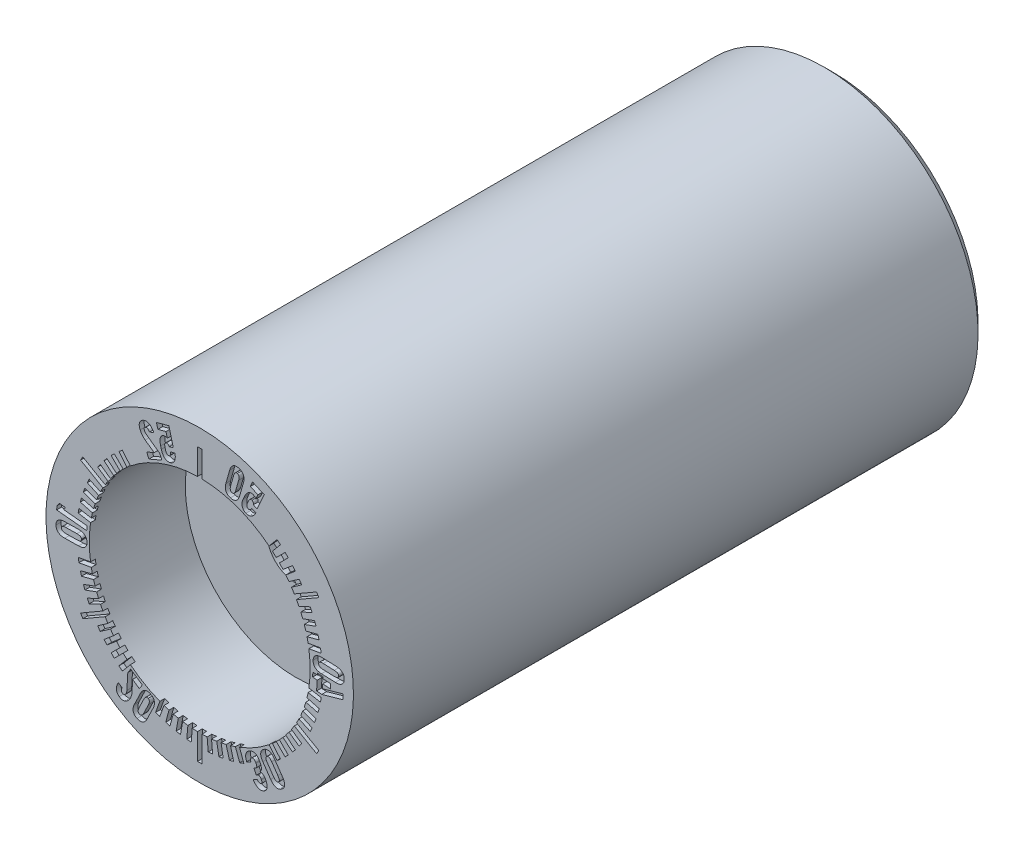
SolidWorks part; units mm, degrees
ref_plane "Front Plane" through (0, 0, 0) normal (0, 0, 1) x (1, 0, 0)
ref_plane "Top Plane" through (0, 0, 0) normal (0, 1, 0) x (1, 0, 0)
ref_plane "Right Plane" through (0, 0, 0) normal (1, 0, 0) x (0, 0, -1)
sketch "Sketch1" plane through (0, 0, 0) normal (1, 0, 0) x (0, 0, -1)
  line L0 (0, 0) -> (-75.4695, 0) construction
  line L2 (33, 4) -> (33, 7.5)
  line L4 (32.5, 8) -> (0, 8)
  line L5 (0, 8) -> (0, 5.75)
  line L7 (0, 5.75) -> (5, 5.75)
  line L8 (5, 5.75) -> (5, 1.5)
  line L9 (5, 1.5) -> (24, 1.5)
  line L10 (33, 4) -> (24, 4)
  line L11 (24, 1.5) -> (24, 4)
  line L12 (33, 7.5) -> (32.5, 8)
  point P6 (33, 8)
  dimension "D1" = 33
  dimension "D2" = 16
  dimension "D3" = 11.5
  dimension "D4" = 5
  dimension "D5" = 3
  dimension "D6" = 8
  dimension "D7" = 9
revolve "Revolve1" add sketch "Sketch1" angle 360 about L0
sketch "Sketch2" plane through (0, 0, 0) normal (0, 0, 1) x (1, 0, 0)
  line L0 (0, 0) -> (0, 9.1999) construction
  line L1 (0, 0) -> (0, -9.4359) construction
  line L2 (-0.614, -5.6982) -> (-0.3848, -5.7182)
  line L3 (-0.115, 7.09) -> (0.115, 7.09)
  line L4 (-0.115, 7.09) -> (-0.115, 5.73)
  line L5 (-0.115, 5.73) -> (0.115, 5.73)
  line L6 (0.115, 7.09) -> (0.115, 5.73)
  line L7 (6.0826, 3.6446) -> (6.1976, 3.4454)
  line L8 (6.1976, 3.4454) -> (5.0198, 2.7654)
  line L9 (6.0826, 3.6446) -> (4.9048, 2.9646)
  line L10 (4.9048, 2.9646) -> (5.0198, 2.7654)
  line L11 (-0.3848, -5.7182) -> (-0.4432, -6.3857)
  line L12 (-0.614, -5.6982) -> (-0.6724, -6.3656)
  line L13 (-0.6724, -6.3656) -> (-0.4432, -6.3857)
  line L14 (-1.1083, -5.623) -> (-0.8818, -5.6629)
  line L15 (-0.8818, -5.6629) -> (-0.9981, -6.3227)
  line L16 (-1.1083, -5.623) -> (-1.2246, -6.2828)
  line L17 (-1.2246, -6.2828) -> (-0.9981, -6.3227)
  line L18 (-1.5941, -5.505) -> (-1.372, -5.5645)
  line L19 (-1.372, -5.5645) -> (-1.5454, -6.2117)
  line L20 (-1.5941, -5.505) -> (-1.7675, -6.1522)
  line L21 (-1.7675, -6.1522) -> (-1.5454, -6.2117)
  line L22 (-2.0678, -5.3451) -> (-1.8517, -5.4238)
  line L23 (-1.8517, -5.4238) -> (-2.0809, -6.0534)
  line L24 (-2.0678, -5.3451) -> (-2.297, -5.9747)
  line L25 (-2.297, -5.9747) -> (-2.0809, -6.0534)
  line L26 (2.4456, -5.8294) -> (2.662, -5.7219)
  line L27 (2.916, -5.6259) -> (2.9326, -5.659)
  line L28 (2.9148, -5.8787) -> (2.8208, -5.9254)
  line L29 (2.8208, -5.9254) -> (2.949, -6.1828)
  line L30 (2.949, -6.1828) -> (3.043, -6.1361)
  line L31 (3.1992, -6.2407) -> (3.2113, -6.2652)
  line L32 (2.9953, -6.3472) -> (2.7799, -6.4546)
  line L33 (3.4495, -6.1807) -> (3.4282, -6.1379)
  line L34 (3.1469, -5.5269) -> (3.1256, -5.4841)
  line L35 (3.2837, -5.4055) -> (3.6928, -5.9979)
  line L36 (4.3062, -5.5741) -> (3.8972, -4.9817)
  line L37 (3.747, -5.178) -> (4.0695, -5.6451)
  line L38 (-3.7713, -4.3155) -> (-3.5951, -4.4634)
  line L39 (-3.5951, -4.4634) -> (-4.0257, -4.9766)
  line L40 (-3.7713, -4.3155) -> (-4.2019, -4.8288)
  line L41 (-4.2019, -4.8288) -> (-4.0257, -4.9766)
  line L42 (-4.133, -3.9704) -> (-3.9704, -4.133)
  line L43 (-3.9704, -4.133) -> (-4.4442, -4.6068)
  line L44 (-4.133, -3.9704) -> (-4.6068, -4.4442)
  line L45 (-4.6068, -4.4442) -> (-4.4442, -4.6068)
  line L46 (-4.4634, -3.5951) -> (-4.3155, -3.7713)
  line L47 (-4.3155, -3.7713) -> (-4.8288, -4.2019)
  line L48 (-4.4634, -3.5951) -> (-4.9766, -4.0257)
  line L49 (-4.9766, -4.0257) -> (-4.8288, -4.2019)
  line L50 (-4.7597, -3.1924) -> (-4.6278, -3.3808)
  line L51 (-4.6278, -3.3808) -> (-5.1766, -3.7651)
  line L52 (-4.7597, -3.1924) -> (-5.3085, -3.5767)
  line L53 (-5.3085, -3.5767) -> (-5.1766, -3.7651)
  line L54 (6.1976, -3.4454) -> (6.0826, -3.6446)
  line L55 (6.0826, -3.6446) -> (4.9048, -2.9646)
  line L56 (6.1976, -3.4454) -> (5.0198, -2.7654)
  line L57 (5.0198, -2.7654) -> (4.9048, -2.9646)
  line L58 (-5.2417, -2.3174) -> (-5.1445, -2.5258)
  line L59 (-5.1445, -2.5258) -> (-5.7518, -2.809)
  line L60 (-5.2417, -2.3174) -> (-5.849, -2.6005)
  line L61 (-5.849, -2.6005) -> (-5.7518, -2.809)
  line L62 (-5.4238, -1.8517) -> (-5.3451, -2.0678)
  line L63 (-5.3451, -2.0678) -> (-5.9747, -2.297)
  line L64 (-5.4238, -1.8517) -> (-6.0534, -2.0809)
  line L65 (-6.0534, -2.0809) -> (-5.9747, -2.297)
  line L66 (-5.5645, -1.372) -> (-5.505, -1.5941)
  line L67 (-5.505, -1.5941) -> (-6.1522, -1.7675)
  line L68 (-5.5645, -1.372) -> (-6.2117, -1.5454)
  line L69 (-6.2117, -1.5454) -> (-6.1522, -1.7675)
  line L70 (-5.6629, -0.8818) -> (-5.623, -1.1083)
  line L71 (-5.623, -1.1083) -> (-6.2828, -1.2246)
  line L72 (-5.6629, -0.8818) -> (-6.3227, -0.9981)
  line L73 (-6.3227, -0.9981) -> (-6.2828, -1.2246)
  line L74 (3.8428, -5.8019) -> (3.5203, -5.3347)
  line L75 (6.3541, -0.8382) -> (7.4436, -0.5291)
  line L76 (7.4436, -0.5291) -> (7.4622, -0.2638)
  line L77 (7.4622, -0.2638) -> (6.3867, -0.5635)
  line L78 (6.3867, -0.5635) -> (6.4023, -0.337)
  line L79 (6.4253, -0.0051) -> (6.1384, 0.0147)
  line L80 (6.1384, 0.0147) -> (6.1316, -0.0826)
  line L81 (6.0805, -0.8191) -> (6.3541, -0.8382)
  line L82 (6.8023, -0.3649) -> (6.8185, -0.1305)
  line L83 (6.8185, -0.1305) -> (6.4185, -0.1026)
  line L84 (5.8883, -0.0657) -> (5.8721, -0.3001)
  line L85 (5.8721, -0.3001) -> (6.1154, -0.317)
  line L86 (-5.623, 1.1083) -> (-5.6629, 0.8818)
  line L87 (-5.6629, 0.8818) -> (-6.3227, 0.9981)
  line L88 (-5.623, 1.1083) -> (-6.2828, 1.2246)
  line L89 (-6.2828, 1.2246) -> (-6.3227, 0.9981)
  line L90 (-5.505, 1.5941) -> (-5.5645, 1.372)
  line L91 (-5.5645, 1.372) -> (-6.2117, 1.5454)
  line L92 (-5.505, 1.5941) -> (-6.1522, 1.7675)
  line L93 (-6.1522, 1.7675) -> (-6.2117, 1.5454)
  line L94 (-5.3451, 2.0678) -> (-5.4238, 1.8517)
  line L95 (-5.4238, 1.8517) -> (-6.0534, 2.0809)
  line L96 (-5.3451, 2.0678) -> (-5.9747, 2.297)
  line L97 (-5.9747, 2.297) -> (-6.0534, 2.0809)
  line L98 (-5.1445, 2.5258) -> (-5.2417, 2.3174)
  line L99 (-5.2417, 2.3174) -> (-5.849, 2.6005)
  line L100 (-5.1445, 2.5258) -> (-5.7518, 2.809)
  line L101 (-5.7518, 2.809) -> (-5.849, 2.6005)
  line L102 (0.115, -7.09) -> (-0.115, -7.09)
  line L103 (-0.115, -7.09) -> (-0.115, -5.73)
  line L104 (0.115, -7.09) -> (0.115, -5.73)
  line L105 (0.115, -5.73) -> (-0.115, -5.73)
  line L106 (-4.6278, 3.3808) -> (-4.7597, 3.1924)
  line L107 (-4.7597, 3.1924) -> (-5.3085, 3.5767)
  line L108 (-4.6278, 3.3808) -> (-5.1766, 3.7651)
  line L109 (-5.1766, 3.7651) -> (-5.3085, 3.5767)
  line L110 (-4.3155, 3.7713) -> (-4.4634, 3.5951)
  line L111 (-4.4634, 3.5951) -> (-4.9766, 4.0257)
  line L112 (-4.3155, 3.7713) -> (-4.8288, 4.2019)
  line L113 (-4.8288, 4.2019) -> (-4.9766, 4.0257)
  line L114 (-3.9704, 4.133) -> (-4.133, 3.9704)
  line L115 (-4.133, 3.9704) -> (-4.6068, 4.4442)
  line L116 (-3.9704, 4.133) -> (-4.4442, 4.6068)
  line L117 (-4.4442, 4.6068) -> (-4.6068, 4.4442)
  line L118 (-3.5951, 4.4634) -> (-3.7713, 4.3155)
  line L119 (-3.7713, 4.3155) -> (-4.2019, 4.8288)
  line L120 (-3.5951, 4.4634) -> (-4.0257, 4.9766)
  line L121 (-4.0257, 4.9766) -> (-4.2019, 4.8288)
  line L122 (6.3372, 0.0845) -> (7.0567, 0.0572)
  line L123 (7.085, 0.8025) -> (6.3655, 0.8298)
  line L124 (6.4329, 0.5921) -> (6.9999, 0.5707)
  line L125 (6.9897, 0.2949) -> (6.4227, 0.3163)
  line L126 (-6.0826, -3.6446) -> (-6.1976, -3.4454)
  line L127 (-6.1976, -3.4454) -> (-5.0198, -2.7654)
  line L128 (-6.0826, -3.6446) -> (-4.9048, -2.9646)
  line L129 (-4.9048, -2.9646) -> (-5.0198, -2.7654)
  line L130 (-6.1976, 3.4454) -> (-6.0826, 3.6446)
  line L131 (-6.0826, 3.6446) -> (-4.9048, 2.9646)
  line L132 (-6.1976, 3.4454) -> (-5.0198, 2.7654)
  line L133 (-5.0198, 2.7654) -> (-4.9048, 2.9646)
  line L134 (6.1316, -0.0826) -> (5.8883, -0.0657)
  line L135 (6.4185, -0.1026) -> (6.4253, -0.0051)
  line L136 (6.4023, -0.337) -> (6.8023, -0.3649)
  line L137 (6.1154, -0.317) -> (6.0805, -0.8191)
  line L182 (3.7713, 4.3155) -> (3.5951, 4.4634)
  line L183 (3.5951, 4.4634) -> (4.0257, 4.9766)
  line L184 (3.7713, 4.3155) -> (4.2019, 4.8288)
  line L185 (4.2019, 4.8288) -> (4.0257, 4.9766)
  line L186 (4.133, 3.9704) -> (3.9704, 4.133)
  line L187 (3.9704, 4.133) -> (4.4442, 4.6068)
  line L188 (4.133, 3.9704) -> (4.6068, 4.4442)
  line L189 (4.6068, 4.4442) -> (4.4442, 4.6068)
  line L190 (4.4634, 3.5951) -> (4.3155, 3.7713)
  line L191 (4.3155, 3.7713) -> (4.8288, 4.2019)
  line L192 (4.4634, 3.5951) -> (4.9766, 4.0257)
  line L193 (4.9766, 4.0257) -> (4.8288, 4.2019)
  line L194 (4.7597, 3.1924) -> (4.6278, 3.3808)
  line L195 (4.6278, 3.3808) -> (5.1766, 3.7651)
  line L196 (4.7597, 3.1924) -> (5.3085, 3.5767)
  line L197 (5.3085, 3.5767) -> (5.1766, 3.7651)
  line L202 (5.2417, 2.3174) -> (5.1445, 2.5258)
  line L203 (5.1445, 2.5258) -> (5.7518, 2.809)
  line L204 (5.2417, 2.3174) -> (5.849, 2.6005)
  line L205 (5.849, 2.6005) -> (5.7518, 2.809)
  line L206 (5.4238, 1.8517) -> (5.3451, 2.0678)
  line L207 (5.3451, 2.0678) -> (5.9747, 2.297)
  line L208 (5.4238, 1.8517) -> (6.0534, 2.0809)
  line L209 (6.0534, 2.0809) -> (5.9747, 2.297)
  line L210 (5.5645, 1.372) -> (5.505, 1.5941)
  line L211 (5.505, 1.5941) -> (6.1522, 1.7675)
  line L212 (5.5645, 1.372) -> (6.2117, 1.5454)
  line L213 (6.2117, 1.5454) -> (6.1522, 1.7675)
  line L214 (5.6629, 0.8818) -> (5.623, 1.1083)
  line L215 (5.623, 1.1083) -> (6.2828, 1.2246)
  line L216 (5.6629, 0.8818) -> (6.3227, 0.9981)
  line L217 (6.3227, 0.9981) -> (6.2828, 1.2246)
  line L230 (5.623, -1.1083) -> (5.6629, -0.8818)
  line L231 (5.6629, -0.8818) -> (6.3227, -0.9981)
  line L232 (5.623, -1.1083) -> (6.2828, -1.2246)
  line L233 (6.2828, -1.2246) -> (6.3227, -0.9981)
  line L234 (5.505, -1.5941) -> (5.5645, -1.372)
  line L235 (5.5645, -1.372) -> (6.2117, -1.5454)
  line L236 (5.505, -1.5941) -> (6.1522, -1.7675)
  line L237 (6.1522, -1.7675) -> (6.2117, -1.5454)
  line L238 (5.3451, -2.0678) -> (5.4238, -1.8517)
  line L239 (5.4238, -1.8517) -> (6.0534, -2.0809)
  line L240 (5.3451, -2.0678) -> (5.9747, -2.297)
  line L241 (5.9747, -2.297) -> (6.0534, -2.0809)
  line L242 (5.1445, -2.5258) -> (5.2417, -2.3174)
  line L243 (5.2417, -2.3174) -> (5.849, -2.6005)
  line L244 (5.1445, -2.5258) -> (5.7518, -2.809)
  line L245 (5.7518, -2.809) -> (5.849, -2.6005)
  line L250 (4.6278, -3.3808) -> (4.7597, -3.1924)
  line L251 (4.7597, -3.1924) -> (5.3085, -3.5767)
  line L252 (4.6278, -3.3808) -> (5.1766, -3.7651)
  line L253 (5.1766, -3.7651) -> (5.3085, -3.5767)
  line L254 (4.3155, -3.7713) -> (4.4634, -3.5951)
  line L255 (4.4634, -3.5951) -> (4.9766, -4.0257)
  line L256 (4.3155, -3.7713) -> (4.8288, -4.2019)
  line L257 (4.8288, -4.2019) -> (4.9766, -4.0257)
  line L258 (3.9704, -4.133) -> (4.133, -3.9704)
  line L259 (4.133, -3.9704) -> (4.6068, -4.4442)
  line L260 (3.9704, -4.133) -> (4.4442, -4.6068)
  line L261 (4.4442, -4.6068) -> (4.6068, -4.4442)
  line L262 (3.5951, -4.4634) -> (3.7713, -4.3155)
  line L263 (3.7713, -4.3155) -> (4.2019, -4.8288)
  line L264 (3.5951, -4.4634) -> (4.0257, -4.9766)
  line L265 (4.0257, -4.9766) -> (4.2019, -4.8288)
  line L278 (1.8517, -5.4238) -> (2.0678, -5.3451)
  line L279 (2.0678, -5.3451) -> (2.297, -5.9747)
  line L280 (1.8517, -5.4238) -> (2.0809, -6.0534)
  line L281 (2.0809, -6.0534) -> (2.297, -5.9747)
  line L282 (1.372, -5.5645) -> (1.5941, -5.505)
  line L283 (1.5941, -5.505) -> (1.7675, -6.1522)
  line L284 (1.372, -5.5645) -> (1.5454, -6.2117)
  line L285 (1.5454, -6.2117) -> (1.7675, -6.1522)
  line L286 (0.8818, -5.6629) -> (1.1083, -5.623)
  line L287 (1.1083, -5.623) -> (1.2246, -6.2828)
  line L288 (0.8818, -5.6629) -> (0.9981, -6.3227)
  line L289 (0.9981, -6.3227) -> (1.2246, -6.2828)
  line L290 (0.3848, -5.7182) -> (0.614, -5.6982)
  line L291 (0.614, -5.6982) -> (0.6724, -6.3656)
  line L292 (0.3848, -5.7182) -> (0.4432, -6.3857)
  line L293 (0.4432, -6.3857) -> (0.6724, -6.3656)
  circle A0 centre (0, 0) radius 5.9 construction
  spline S0 degree 3 poles (2.6045, -5.2554) (2.5726, -5.2714) (2.5278, -5.3006) (2.478, -5.3499) (2.4475, -5.391) (2.4228, -5.4358) (2.4047, -5.4843) (2.3939, -5.5362) (2.3896, -5.5911) (2.3923, -5.6486) (2.4062, -5.73) (2.4281, -5.7898) (2.4456, -5.8294) knots 0 0 0 0 0.161106 0.238201 0.314561 0.390768 0.46798 0.54646 0.629043 0.715177 0.804753 1 1 1 1
  spline S1 degree 3 poles (2.662, -5.7219) (2.6518, -5.6949) (2.6429, -5.6541) (2.6481, -5.6018) (2.6651, -5.5591) (2.6908, -5.5356) (2.7108, -5.5262) knots 0 0 0 0 0.389245 0.552171 0.702169 1 1 1 1
  spline S2 degree 3 poles (2.7108, -5.5262) (2.7289, -5.5177) (2.758, -5.5079) (2.7975, -5.5121) (2.8252, -5.522) (2.8512, -5.5388) (2.8853, -5.5713) (2.9042, -5.6033) (2.916, -5.6259) knots 0 0 0 0 0.234386 0.344211 0.455537 0.57454 0.701359 1 1 1 1
  spline S3 degree 3 poles (2.9326, -5.659) (2.9441, -5.6831) (2.9598, -5.7184) (2.9683, -5.7659) (2.9696, -5.7963) (2.9646, -5.8234) (2.9502, -5.8548) (2.9297, -5.8713) (2.9148, -5.8787) knots 0 0 0 0 0.327056 0.463872 0.585664 0.694908 0.796361 1 1 1 1
  spline S4 degree 3 poles (3.043, -6.1361) (3.0553, -6.1297) (3.0766, -6.1256) (3.1046, -6.1324) (3.125, -6.1439) (3.1451, -6.1605) (3.1719, -6.1921) (3.1892, -6.22) (3.1992, -6.2407) knots 0 0 0 0 0.198238 0.297496 0.408103 0.531348 0.669627 1 1 1 1
  spline S5 degree 3 poles (3.2113, -6.2652) (3.2207, -6.2847) (3.233, -6.3136) (3.2389, -6.3525) (3.2385, -6.3778) (3.2332, -6.4005) (3.2188, -6.4268) (3.2011, -6.4413) (3.1875, -6.4476) knots 0 0 0 0 0.315551 0.448835 0.569436 0.679684 0.783667 1 1 1 1
  spline S6 degree 3 poles (3.1875, -6.4476) (3.1783, -6.4523) (3.1632, -6.4564) (3.1423, -6.4573) (3.1263, -6.4546) (3.1098, -6.45) (3.0933, -6.4425) (3.0766, -6.4327) (3.06, -6.4204) (3.0432, -6.4057) (3.0208, -6.3817) (3.0054, -6.3615) (2.9953, -6.3472) knots 0 0 0 0 0.131372 0.19643 0.264883 0.336662 0.41385 0.494997 0.582418 0.676905 0.777945 1 1 1 1
  spline S7 degree 3 poles (2.7799, -6.4546) (2.8029, -6.4938) (2.841, -6.5485) (2.8993, -6.6123) (2.9445, -6.6513) (2.991, -6.6835) (3.0385, -6.7088) (3.0869, -6.7264) (3.1357, -6.7367) (3.1844, -6.7395) (3.2489, -6.7334) (3.2954, -6.7178) (3.3244, -6.7031) knots 0 0 0 0 0.205722 0.300436 0.390488 0.475582 0.555837 0.633119 0.707862 0.781016 0.852868 1 1 1 1
  spline S8 degree 3 poles (3.3244, -6.7031) (3.3475, -6.6913) (3.3804, -6.6717) (3.4189, -6.6401) (3.4435, -6.6148) (3.4642, -6.5873) (3.4817, -6.558) (3.4951, -6.5265) (3.5053, -6.4934) (3.5118, -6.4587) (3.5141, -6.4226) (3.5129, -6.3852) (3.5076, -6.3465) (3.4989, -6.3066) (3.4815, -6.2502) (3.4633, -6.2085) (3.4495, -6.1807) knots 0 0 0 0 0.127639 0.187303 0.244723 0.300676 0.356461 0.411896 0.468674 0.52651 0.585218 0.646388 0.710215 0.776858 0.84718 1 1 1 1
  spline S9 degree 3 poles (3.4282, -6.1379) (3.4128, -6.107) (3.3861, -6.0636) (3.3411, -6.0149) (3.305, -5.9851) (3.2663, -5.9611) (3.2115, -5.9389) (3.1679, -5.9312) (3.1386, -5.9314) knots 0 0 0 0 0.276132 0.404288 0.528875 0.649662 0.766898 1 1 1 1
  spline S10 degree 3 poles (3.1386, -5.9314) (3.161, -5.911) (3.1878, -5.8723) (3.2061, -5.8119) (3.211, -5.7612) (3.2076, -5.7066) (3.1907, -5.6262) (3.1671, -5.5665) (3.1469, -5.5269) knots 0 0 0 0 0.208986 0.317147 0.433273 0.559006 0.69352 1 1 1 1
  spline S11 degree 3 poles (3.1256, -5.4841) (3.107, -5.4453) (3.0742, -5.392) (3.0235, -5.3291) (2.9834, -5.2912) (2.9417, -5.2598) (2.8974, -5.2367) (2.8517, -5.2199) (2.804, -5.2119) (2.755, -5.211) (2.6865, -5.2206) (2.6368, -5.2397) (2.6045, -5.2554) knots 0 0 0 0 0.199663 0.289879 0.374673 0.454952 0.531757 0.606027 0.680061 0.755356 0.832919 1 1 1 1
  spline S12 degree 3 poles (3.3346, -4.8235) (3.3108, -4.8396) (3.2781, -4.8664) (3.2412, -4.9071) (3.2189, -4.9387) (3.2009, -4.9716) (3.1871, -5.0061) (3.1781, -5.0422) (3.1733, -5.0796) (3.1727, -5.1182) (3.1762, -5.1574) (3.1842, -5.1973) (3.1957, -5.238) (3.2117, -5.2791) (3.2391, -5.3364) (3.2648, -5.378) (3.2837, -5.4055) knots 0 0 0 0 0.129871 0.190225 0.247875 0.304196 0.359503 0.415159 0.471987 0.529676 0.588904 0.649887 0.713335 0.779641 0.84894 1 1 1 1
  spline S13 degree 3 poles (3.6928, -5.9979) (3.7118, -6.0256) (3.742, -6.0646) (3.7861, -6.1108) (3.8192, -6.1403) (3.8532, -6.1655) (3.8877, -6.1871) (3.9234, -6.2039) (3.9594, -6.217) (3.9961, -6.2257) (4.033, -6.2295) (4.0699, -6.2289) (4.107, -6.2238) (4.1443, -6.2139) (4.1952, -6.1937) (4.2315, -6.1724) (4.2552, -6.1564) knots 0 0 0 0 0.152206 0.222058 0.288529 0.352082 0.413336 0.472219 0.52994 0.586186 0.641826 0.697123 0.752898 0.810629 0.870722 1 1 1 1
  spline S14 degree 3 poles (4.2552, -6.1564) (4.2786, -6.1398) (4.3118, -6.1136) (4.3485, -6.0728) (4.3708, -6.0413) (4.3891, -6.0086) (4.4032, -5.9743) (4.4125, -5.9384) (4.4175, -5.9011) (4.418, -5.8629) (4.4149, -5.8237) (4.4068, -5.784) (4.3953, -5.7431) (4.3791, -5.7018) (4.3515, -5.6439) (4.3251, -5.602) (4.3062, -5.5741) knots 0 0 0 0 0.129652 0.189922 0.247023 0.303334 0.358575 0.414101 0.470268 0.527877 0.586376 0.647274 0.710633 0.777531 0.847419 1 1 1 1
  spline S15 degree 3 poles (3.8972, -4.9817) (3.8781, -4.9539) (3.8479, -4.915) (3.8037, -4.8686) (3.7706, -4.8393) (3.7366, -4.8139) (3.7022, -4.7924) (3.6665, -4.7756) (3.6305, -4.7626) (3.5939, -4.7539) (3.5569, -4.7499) (3.5198, -4.7511) (3.4826, -4.7558) (3.4455, -4.766) (3.3946, -4.786) (3.3583, -4.8074) (3.3346, -4.8235) knots 0 0 0 0 0.152176 0.222013 0.288924 0.351999 0.413241 0.472112 0.529822 0.586056 0.641685 0.697151 0.753342 0.810667 0.870748 1 1 1 1
  spline S16 degree 3 poles (3.4982, -5.0604) (3.5157, -5.0485) (3.5463, -5.035) (3.5895, -5.0387) (3.6211, -5.0508) (3.6525, -5.0713) (3.6978, -5.1116) (3.7276, -5.15) (3.747, -5.178) knots 0 0 0 0 0.207401 0.307193 0.41336 0.532363 0.669041 1 1 1 1
  spline S17 degree 3 poles (4.0695, -5.6451) (4.089, -5.673) (4.1138, -5.7145) (4.1357, -5.771) (4.1439, -5.8078) (4.1439, -5.8417) (4.1326, -5.8835) (4.1094, -5.9076) (4.0919, -5.9196) knots 0 0 0 0 0.330238 0.465955 0.586664 0.693024 0.79226 1 1 1 1
  spline S18 degree 3 poles (4.0919, -5.9196) (4.0744, -5.9316) (4.0437, -5.9449) (4.0006, -5.9408) (3.969, -5.9288) (3.9375, -5.9083) (3.8922, -5.8679) (3.8622, -5.8298) (3.8428, -5.8019) knots 0 0 0 0 0.208249 0.306744 0.412902 0.532913 0.66958 1 1 1 1
  spline S19 degree 3 poles (3.5203, -5.3347) (3.5011, -5.3066) (3.4755, -5.2653) (3.4539, -5.2085) (3.4461, -5.1717) (3.4459, -5.1379) (3.4579, -5.0964) (3.4806, -5.0723) (3.4982, -5.0604) knots 0 0 0 0 0.331048 0.467565 0.587735 0.694108 0.792236 1 1 1 1
  spline S20 degree 3 poles (5.9016, 0.4743) (5.9007, 0.4456) (5.9018, 0.4031) (5.9132, 0.3493) (5.9247, 0.3125) (5.9403, 0.2782) (5.9597, 0.2464) (5.9832, 0.2175) (6.0104, 0.1913) (6.0408, 0.1676) (6.0746, 0.1473) (6.111, 0.1294) (6.1506, 0.1145) (6.1931, 0.1028) (6.2552, 0.0897) (6.304, 0.0861) (6.3372, 0.0845) knots 0 0 0 0 0.130183 0.190304 0.248065 0.304374 0.360053 0.415608 0.472265 0.530407 0.589415 0.650323 0.713491 0.779906 0.849589 1 1 1 1
  spline S21 degree 3 poles (7.0567, 0.0572) (7.0903, 0.0562) (7.1397, 0.0566) (7.2032, 0.0646) (7.2467, 0.0731) (7.2874, 0.085) (7.3252, 0.1002) (7.3602, 0.1184) (7.3921, 0.1397) (7.4208, 0.164) (7.4462, 0.1911) (7.4675, 0.2213) (7.4859, 0.254) (7.4999, 0.2899) (7.5142, 0.3427) (7.5196, 0.3844) (7.5203, 0.4131) knots 0 0 0 0 0.152073 0.222273 0.288816 0.352284 0.413223 0.472651 0.530126 0.58636 0.642109 0.697247 0.753072 0.810939 0.87087 1 1 1 1
  spline S22 degree 3 poles (7.5203, 0.4131) (7.5217, 0.4418) (7.5194, 0.4839) (7.5097, 0.538) (7.4977, 0.5747) (7.4827, 0.609) (7.4633, 0.6405) (7.4405, 0.6697) (7.4136, 0.6958) (7.3834, 0.7192) (7.3499, 0.7398) (7.3135, 0.7578) (7.2737, 0.7721) (7.2312, 0.7846) (7.1681, 0.7967) (7.1188, 0.801) (7.085, 0.8025) knots 0 0 0 0 0.129601 0.189846 0.247559 0.303577 0.358531 0.414044 0.470273 0.527288 0.586456 0.647314 0.710308 0.777229 0.847291 1 1 1 1
  spline S23 degree 3 poles (6.3655, 0.8298) (6.3319, 0.8308) (6.2826, 0.8302) (6.2191, 0.8226) (6.1756, 0.8133) (6.135, 0.8017) (6.0971, 0.7869) (6.0622, 0.7687) (6.0301, 0.7477) (6.0015, 0.7233) (5.9761, 0.6962) (5.9546, 0.6659) (5.9364, 0.6332) (5.9224, 0.5973) (5.9073, 0.5447) (5.9032, 0.5028) (5.9016, 0.4743) knots 0 0 0 0 0.152128 0.222354 0.288607 0.352548 0.413284 0.472062 0.529932 0.586187 0.641957 0.697116 0.753409 0.810831 0.870865 1 1 1 1
  spline S24 degree 3 poles (6.189, 0.4632) (6.1893, 0.4845) (6.1981, 0.5163) (6.2263, 0.5491) (6.2552, 0.5671) (6.2907, 0.5799) (6.3503, 0.5921) (6.3988, 0.5934) (6.4329, 0.5921) knots 0 0 0 0 0.206874 0.305502 0.412665 0.53262 0.669385 1 1 1 1
  spline S25 degree 3 poles (6.9999, 0.5707) (7.034, 0.5696) (7.0821, 0.5643) (7.1406, 0.5481) (7.1748, 0.5324) (7.202, 0.5122) (7.2281, 0.4777) (7.234, 0.4451) (7.2329, 0.4238) knots 0 0 0 0 0.33143 0.466798 0.586952 0.694421 0.792381 1 1 1 1
  spline S26 degree 3 poles (7.2329, 0.4238) (7.2328, 0.4024) (7.2243, 0.3704) (7.1958, 0.3379) (7.167, 0.3201) (7.1318, 0.3066) (7.0722, 0.2945) (7.0237, 0.2938) (6.9897, 0.2949) knots 0 0 0 0 0.207934 0.305765 0.412989 0.53256 0.669403 1 1 1 1
  spline S27 degree 3 poles (6.4227, 0.3163) (6.3886, 0.3179) (6.3402, 0.3219) (6.2818, 0.3389) (6.2476, 0.3546) (6.2199, 0.3745) (6.1944, 0.4095) (6.1875, 0.4417) (6.189, 0.4632) knots 0 0 0 0 0.330758 0.467087 0.587022 0.693755 0.7923 1 1 1 1
  text T0 "                              50           52                           10                       20                   " font "Bahnschrift" height 1.58
  point P140 (0, 0)
  point P302 (0, 0)
  point P314 (0, 0)
  dimension "D1" = 11.8
  dimension "D3" = 0.23
  dimension "D4" = 0.115
  dimension "D5" = 1.36
extrude "Cut-Extrude1" cut sketch "Sketch2" against normal blind 0.25
